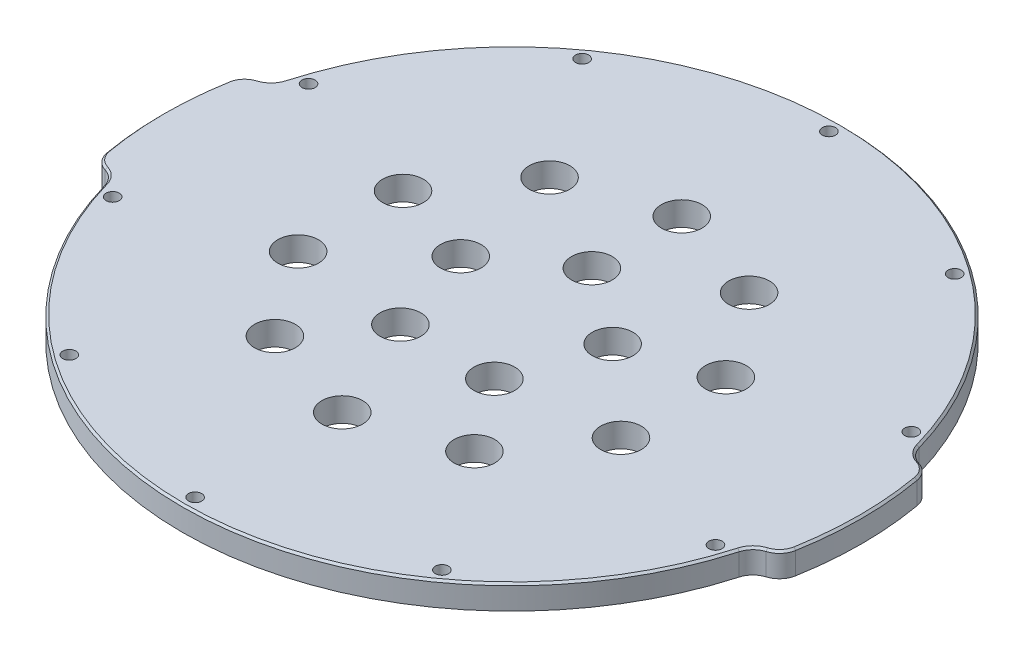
SolidWorks part; units mm, degrees
other "<WTE6-M-END-CAP-15-HOLE-R1>-<Chamfer1>"
ref_plane "Front Plane" through (0, 0, 0) normal (0, 0, 1) x (1, 0, 0)
ref_plane "Top Plane" through (0, 0, 0) normal (0, 1, 0) x (1, 0, 0)
ref_plane "Right Plane" through (0, 0, 0) normal (1, 0, 0) x (0, 0, -1)
inserted part "WTE6-M-END-CAP-15-HOLE-R1"
